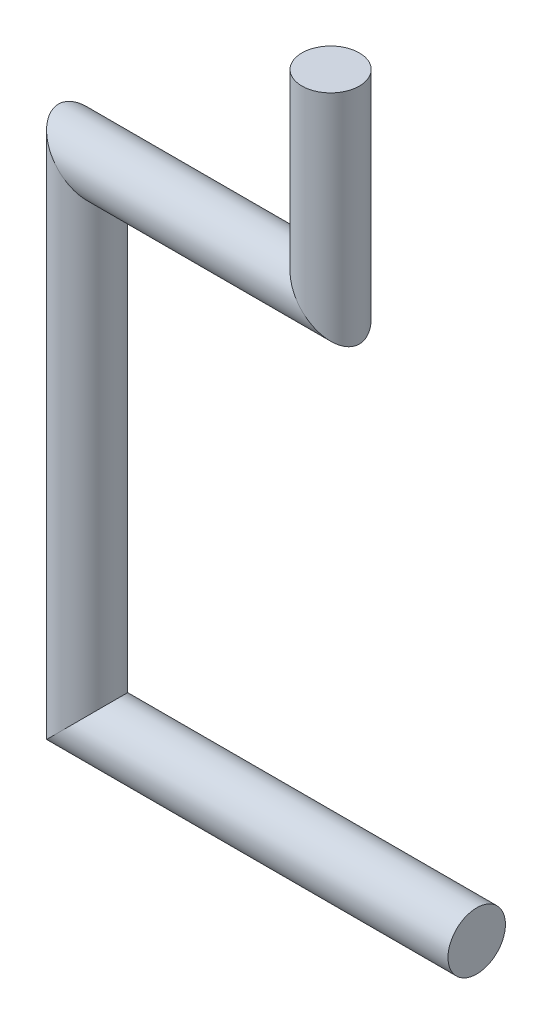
SolidWorks part; units mm, degrees
ref_plane "Front Plane" through (0, 0, 0) normal (0, 0, 1) x (1, 0, 0)
ref_plane "Top Plane" through (0, 0, 0) normal (0, 1, 0) x (1, 0, 0)
ref_plane "Right Plane" through (0, 0, 0) normal (1, 0, 0) x (0, 0, -1)
sketch "Sketch1" plane through (0, 0, 0) normal (0, 0, 1) x (1, 0, 0)
  line L0 (0, 0) -> (0, 127)
  line L1 (0, 127) -> (63.5, 127)
  line L2 (63.5, 127) -> (63.5, 177.8)
  line L3 (0, 0) -> (101.6, 0)
  dimension "D1" = 127
  dimension "D2" = 63.5
  dimension "D3" = 50.8
  dimension "D4" = 101.6
sketch3d "3DSketch1"
  line L0 (0, 0, 0) -> (101.6, 0, 0) construction
  circle A1 centre (101.6, 0, 0) radius 7.493
  point P2 (94.107, 0, 0)
  point P3 (101.6, 0, 0)
  dimension "D1" = 14.986
sweep "Sweep3" add profiles "3DSketch1" path "Sketch1"
